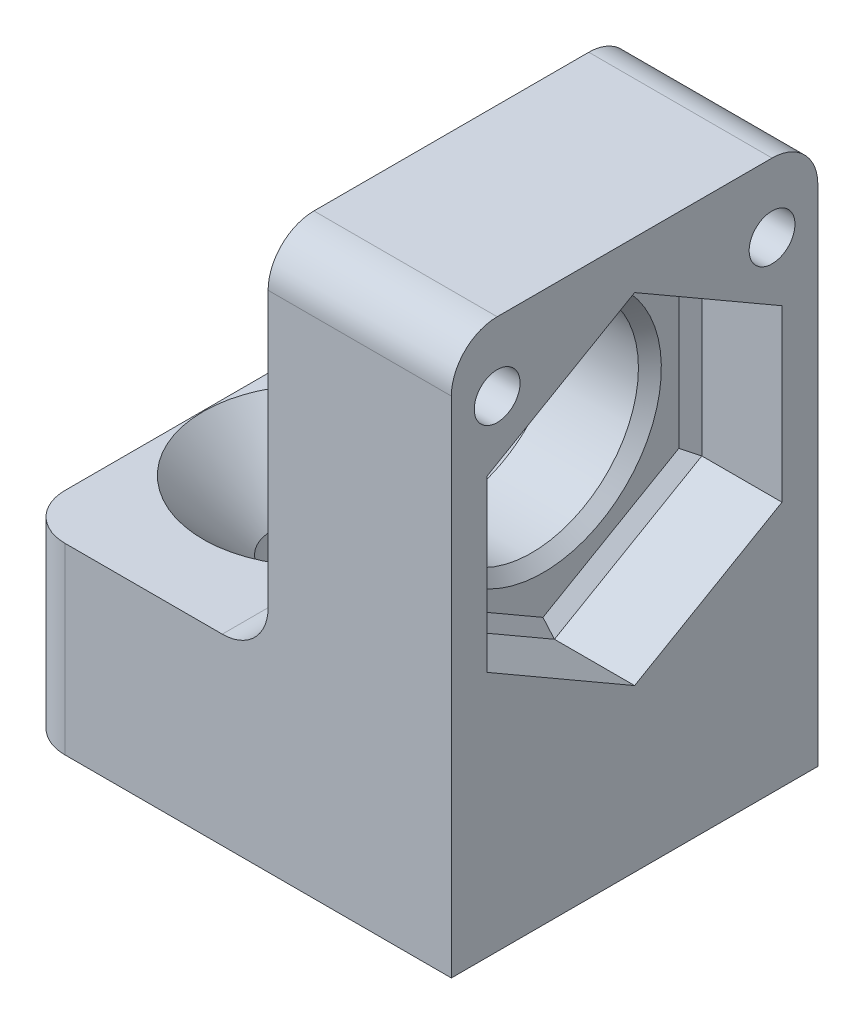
SolidWorks part; units mm, degrees
ref_plane "Plan de face" through (0, 0, 0) normal (0, 0, 1) x (1, 0, 0)
ref_plane "Plan de dessus" through (0, 0, 0) normal (0, 1, 0) x (1, 0, 0)
ref_plane "Plan de droite" through (0, 0, 0) normal (1, 0, 0) x (0, 0, -1)
sketch "Esquisse1" plane through (0, 0, 0) normal (0, 0, 1) x (1, 0, 0)
  line L0 (-12, 7.5) -> (-28.3004, 7.5)
  line L1 (0, -4.5) -> (-28.3004, -4.5)
  line L4 (-28.3004, -4.5) -> (-28.3004, 7.5)
  line L5 (28.3004, -7.5) -> (-28.3004, 7.5) construction
  line L6 (29.5278, 4.6952) -> (-28.3004, -4.5) construction
  line L7 (0, 31.5) -> (-12, 31.5)
  line L9 (0, 31.5) -> (0, -4.5)
  line L10 (-12, 31.5) -> (-12, 7.5)
  point P0 (0, 0)
  point P6 (0, 31.5)
  dimension "D1" = 12
  dimension "D2" = 12
  dimension "D3" = 24
extrude "Boss.-Extru.1" add sketch "Esquisse1" along normal mid plane 24
sketch "Esquisse2" plane through (8, 0, 0) normal (1, 0, 0) x (0, 0, -1)
  line L0 (0, 0) -> (0, 17.2275) construction
  line L1 (-12, 31.5) -> (12, 31.5) construction
  circle A0 centre (0, 17.2275) radius 7
  circle A1 centre (-9, 27) radius 1.5
  circle A2 centre (9, 27) radius 1.5
  dimension "D1" = 14
  dimension "D2" = 18
  dimension "D3" = 4.5
  dimension "D4" = 3
extrude "Enlèv. mat.-Extru.1" cut sketch "Esquisse2" against normal through all
sketch "Esquisse4" plane through (0, 7.5, 0) normal (0, 1, 0) x (1, 0, 0)
  line L2 (0, -12) -> (0, 12) construction
  circle A0 centre (-21, 0) radius 2.75
  dimension "D1" = 5.5
  dimension "D2" = 21
extrude "Enlèv. mat.-Extru.3" cut sketch "Esquisse4" against normal through all
chamfer "Chanfrein1" distance 4.5 angle 45 1 edges at (-23.75, 7.5, 0)
fillet "Congé1" radius 3 5 edges at (-6, 31.5, -12) (-6, 31.5, 12) (-28.3004, 1.5, -12) (-28.3004, 1.5, 12) (-12, 7.5, 0)
sketch "Esquisse5" plane through (0, 0, 0) normal (1, 0, 0) x (0, 0, -1)
  line L1 (0, 28.3704) -> (-9.65, 22.7989)
  line L2 (-9.65, 22.7989) -> (-9.65, 11.6561)
  line L3 (-9.65, 11.6561) -> (0, 6.0846)
  line L4 (0, 6.0846) -> (9.65, 11.6561)
  line L5 (9.65, 11.6561) -> (9.65, 22.7989)
  line L6 (9.65, 22.7989) -> (0, 28.3704)
  circle A0 centre (0, 17.2275) radius 9.65 construction
  dimension "D1" = 19.3
extrude "Enlèv. mat.-Extru.4" cut sketch "Esquisse5" against normal blind 6
chamfer "Chanfrein3" distance 0.75 angle 45 7 edges at (-6, 24.2275, 0) (-6, 17.2275, -9.65) (-6, 8.8703, -4.825) (-6, 8.8703, 4.825) (-6, 17.2275, 9.65) (-6, 25.5846, 4.825) (-6, 25.5846, -4.825)
